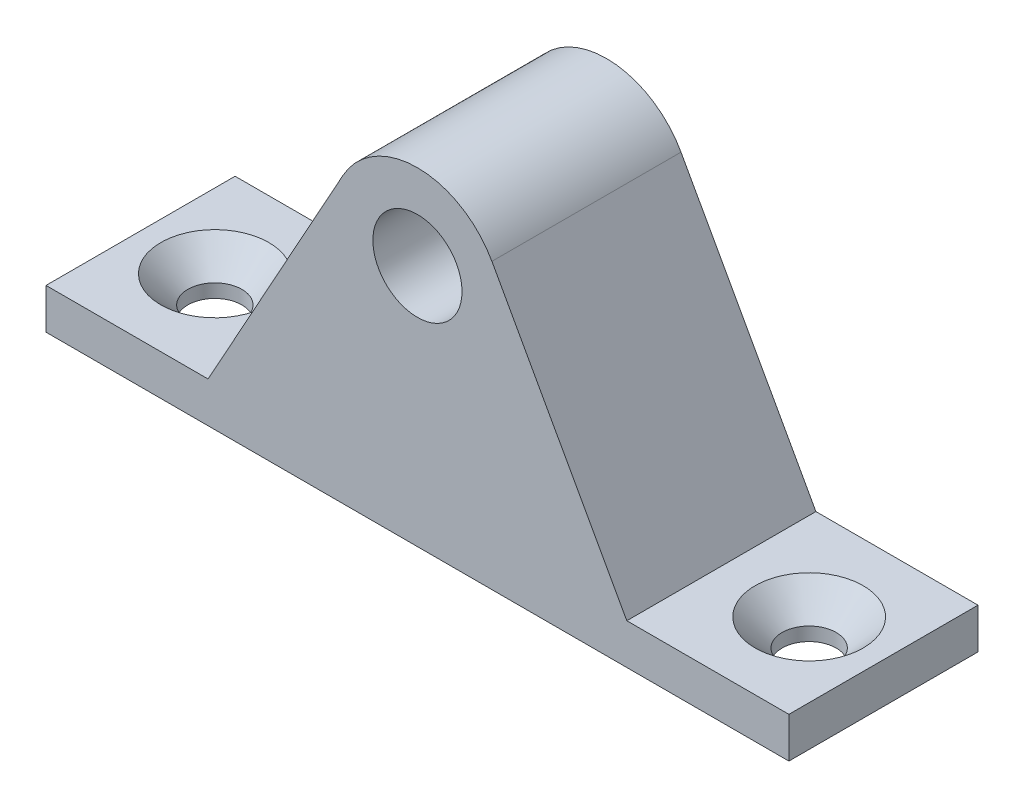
SolidWorks part; units mm, degrees
ref_plane "Plan de face" through (0, 0, 0) normal (0, 0, 1) x (1, 0, 0)
ref_plane "Plan de dessus" through (0, 0, 0) normal (0, 1, 0) x (1, 0, 0)
ref_plane "Plan de droite" through (0, 0, 0) normal (1, 0, 0) x (0, 0, -1)
sketch "Esquisse1" plane through (0, 0, 0) normal (0, 0, 1) x (1, 0, 0)
  line L0 (-27.5, 0) -> (27.5, 0)
  line L1 (27.5, 0) -> (27.5, 3)
  line L2 (27.5, 3) -> (15.5, 3)
  line L3 (15.5, 3) -> (5.5124, 21.0501)
  line L4 (-5.5124, 21.0501) -> (-15.5, 3)
  line L5 (-15.5, 3) -> (-27.5, 3)
  line L6 (-27.5, 3) -> (-27.5, 0)
  arc A0 (5.5124, 21.0501) -> (-5.5124, 21.0501) centre (0, 18) ccw
  circle A1 centre (0, 18) radius 3.3
  dimension "D1" = 6.6
  dimension "D2" = 3
  dimension "D3" = 18
  dimension "D4" = 3
  dimension "D5" = 55
  dimension "D6" = 12
extrude "Boss.-Extru.1" add sketch "Esquisse1" along normal mid plane 14
sketch "Esquisse2" plane through (0, 3, 0) normal (0, 1, 0) x (1, 0, 0)
  line L0 (-22, 0) -> (22, 0) construction
  circle A0 centre (-22, 0) radius 2
  circle A1 centre (22, 0) radius 2
  dimension "D2" = 4
  dimension "D1" = 44
extrude "Enlèv. mat.-Extru.1" cut sketch "Esquisse2" against normal through all
chamfer "Chanfrein1" distance 2 angle 45 2 edges at (-24, 3, 0) (20, 3, 0)
sketch "Esquisse3" plane through (0, 0, -7) normal (0, 0, -1) x (-1, 0, 0)
  line L0 (11.723, 9.826) -> (17.16, 0)
  line L1 (5.5124, 21.0501) -> (15.5, 3) construction
  line L2 (27.5, 0) -> (-27.5, 0) construction
  line L3 (17.16, 0) -> (3.9189, 0)
  line L4 (3.9189, 0) -> (3.9189, 9.826)
  line L5 (3.9189, 9.826) -> (11.723, 9.826)
extrude "Boss.-Extru.2" add sketch "Esquisse3" along normal blind 8
sketch "Esquisse4" plane through (-3.9189, 0, 0) normal (1, 0, 0) x (0, 0, -1)
  circle A0 centre (10.8463, 6.3099) radius 1.25
  point P2 (10.8463, 6.3099)
  dimension "D1" = 2.5
extrude "Enlèv. mat.-Extru.2" cut sketch "Esquisse4" against normal through all
sketch "Esquisse5" plane through (-3.9189, 0, 0) normal (1, 0, 0) x (0, 0, -1)
  circle A0 centre (10.8463, 6.3099) radius 3
  dimension "D1" = 6
extrude "Enlèv. mat.-Extru.3" cut sketch "Esquisse5" against normal through all from offset 4
